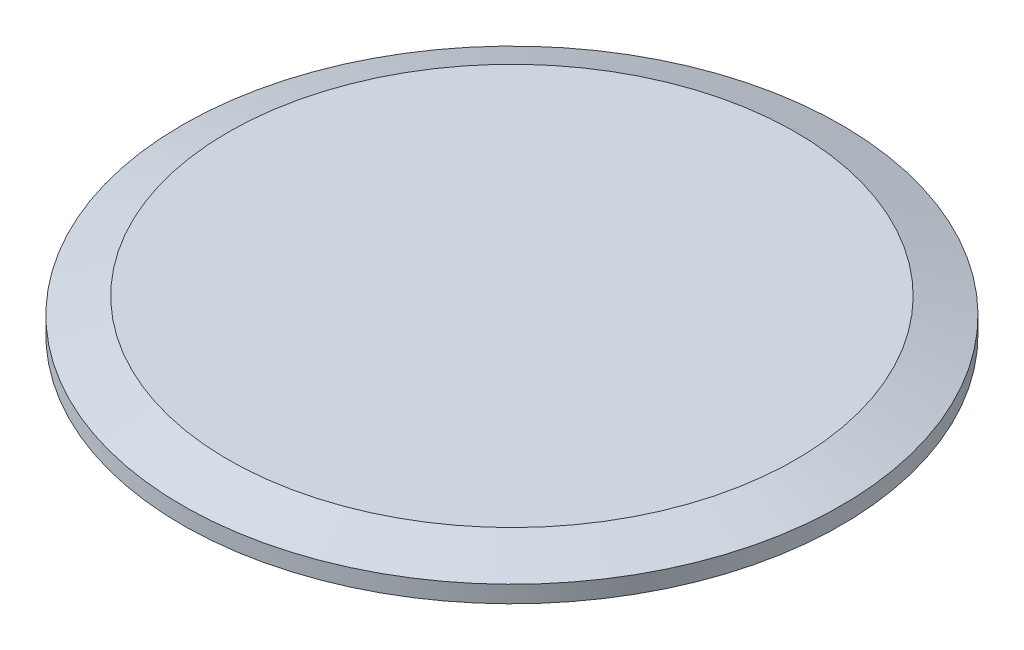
SolidWorks part; units mm, degrees
ref_plane "Front Plane" through (0, 0, 0) normal (0, 0, 1) x (1, 0, 0)
ref_plane "Top Plane" through (0, 0, 0) normal (0, 1, 0) x (1, 0, 0)
ref_plane "Right Plane" through (0, 0, 0) normal (1, 0, 0) x (0, 0, -1)
sketch "Sketch1" plane through (0, 0, 0) normal (0, 0, 1) x (1, 0, 0)
  line L0 (0, 0) -> (-101.7632, 0)
  line L1 (-108.839, 0) -> (-108.839, 5.588)
  line L2 (-108.839, 5.588) -> (-93.6955, 11.0998)
  line L3 (-93.6955, 11.0998) -> (0, 11.0998)
  line L4 (0, 11.0998) -> (0, 0) construction
  line L5 (-105.3992, 0) -> (-108.839, 0)
  line L6 (0, 0) -> (0, 11.0998)
  arc A0 (-102.4857, 0.4745) -> (-104.6767, 0.4745) centre (-103.5812, 0) ccw
  arc A1 (-101.7632, 0) -> (-102.4857, 0.4745) centre (-101.7632, 0.7874) cw
  arc A2 (-105.3992, 0) -> (-104.6767, 0.4745) centre (-105.3992, 0.7874) ccw
  point P13 (-104.775, 0)
  dimension "D1" = 2.3876
  dimension "D2" = 0.7874
  dimension "D3" = 108.839
  dimension "D4" = 103.5812
  dimension "D5" = 5.588
  dimension "D6" = 20
  dimension "D7" = 11.0998
revolve "Revolve1" add sketch "Sketch1" angle 360 about L4
